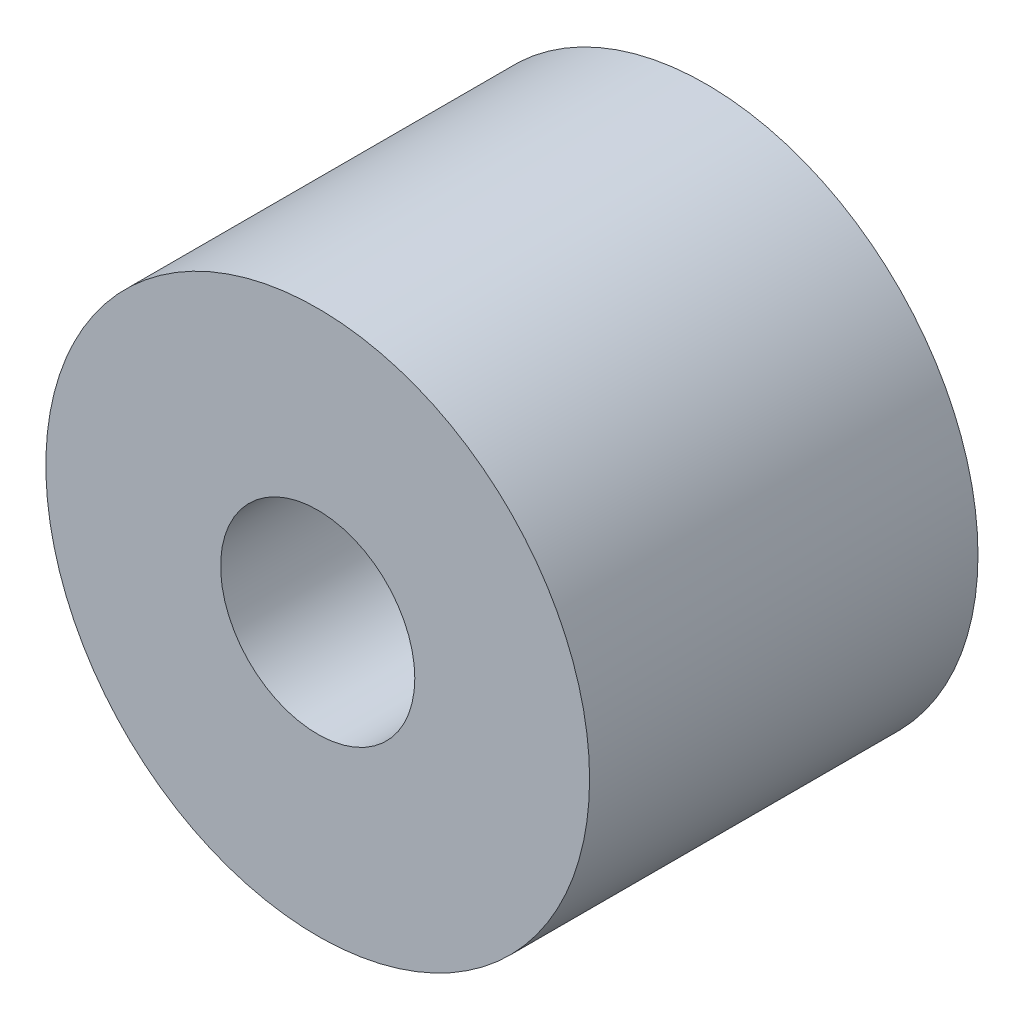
SolidWorks part; units mm, degrees
ref_plane "Front Plane" through (0, 0, 0) normal (0, 0, 1) x (1, 0, 0)
ref_plane "Top Plane" through (0, 0, 0) normal (0, 1, 0) x (1, 0, 0)
ref_plane "Right Plane" through (0, 0, 0) normal (1, 0, 0) x (0, 0, -1)
sketch "Sketch1" plane through (0, 0, 0) normal (0, 0, 1) x (1, 0, 0)
  circle A0 centre (0, 0) radius 4.445
  circle A1 centre (0, 0) radius 1.5875
  dimension "D1" = 3.175
  dimension "D2" = 8.89
extrude "Boss-Extrude1" add sketch "Sketch1" along normal blind 6.35
